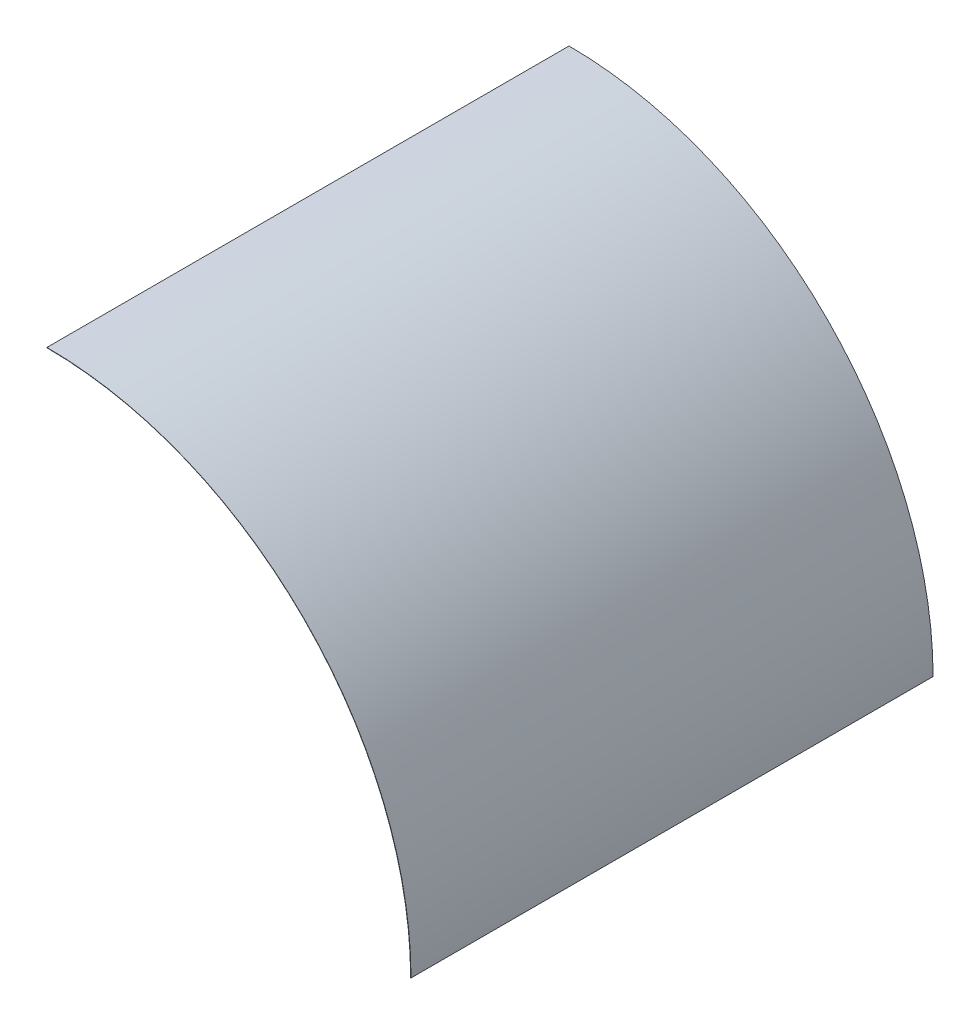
SolidWorks part; units mm, degrees
ref_plane "Front Plane" through (0, 0, 0) normal (0, 0, 1) x (1, 0, 0)
ref_plane "Top Plane" through (0, 0, 0) normal (0, 1, 0) x (1, 0, 0)
ref_plane "Right Plane" through (0, 0, 0) normal (1, 0, 0) x (0, 0, -1)
sketch "Sketch1" plane through (0, 0, 0) normal (0, 0, 1) x (1, 0, 0)
  line L0 (0, 0) -> (0, 45.174) construction
  line L1 (0, 0) -> (40.8023, 0) construction
  line L2 (0, 2092) -> (0, 2090)
  line L3 (2092, 0) -> (2090, 0)
  arc A0 (0, 2090) -> (2090, 0) centre (0, 0) cw
  arc A1 (0, 2092) -> (2092, 0) centre (0, 0) cw
  dimension "D1" = 2090
  dimension "D2" = 2
extrude "Boss-Extrude1" add sketch "Sketch1" against normal blind 3000
